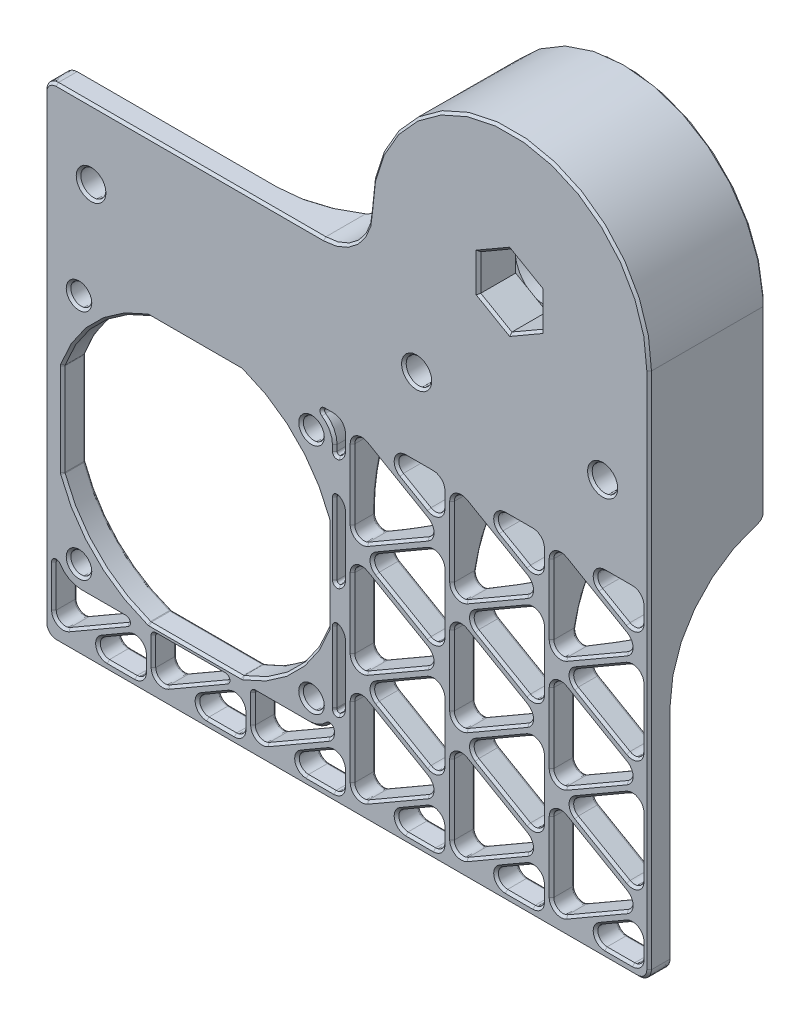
SolidWorks part; units mm, degrees
other "<Mocowanie szpulki baza z wiatrakiem>-<Sfazowanie5>"
ref_plane "Płaszczyzna przednia" through (0, 0, 0) normal (0, 0, 1) x (1, 0, 0)
ref_plane "Płaszczyzna górna" through (0, 0, 0) normal (0, 1, 0) x (1, 0, 0)
ref_plane "Płaszczyzna prawa" through (0, 0, 0) normal (1, 0, 0) x (0, 0, -1)
sketch "Szkic1-Mocowanie szpulki baza z wiatrakiem_Odbicie lustrzane" plane through (0, 0, 0) normal (0, 0, 1) x (1, 0, 0)
  line L0 (0, 0) -> (0, 40)
  line L1 (0, 0) -> (60, 0)
  line L2 (60, 0) -> (60, 40)
  arc A0 (0, 40) -> (60, 40) centre (30, 40) cw
  dimension "D1" = 60
  dimension "D2" = 40
sketch "Szkic7-Mocowanie szpulki baza z wiatrakiem_Odbicie lustrzane" plane through (0, 0, 0) normal (0, 1, 0) x (1, 0, 0)
  line L1 (0, 0) -> (60, 0)
  line L2 (0, 0) -> (0, 5)
  line L3 (0, 5) -> (60, 5)
  line L4 (60, 0) -> (60, 5)
  dimension "D1" = 5
sketch "Szkic9-Mocowanie szpulki baza z wiatrakiem_Odbicie lustrzane" plane through (0, 0, 0) normal (1, 0, 0) x (0, 0, -1)
  line L1 (5, -74) -> (0, -74)
  line L2 (5, -74) -> (5, 30)
  line L3 (5, 30) -> (0, 30)
  line L4 (0, -74) -> (0, 30)
sketch "Szkic10-Mocowanie szpulki baza z wiatrakiem_Odbicie lustrzane" plane through (0, 0, -5) normal (0, 0, 1) x (1, 0, 0)
  line L0 (10, 15) -> (-60, 15) construction
  circle A0 centre (-60, 15) radius 2.7
  dimension "D1" = 5.4
sketch "Szkic12-Mocowanie szpulki baza z wiatrakiem_Odbicie lustrzane" plane through (0, 0, 0) normal (0, 0, -1) x (-1, 0, 0)
  line L1 (-30, 47.7365) -> (-36.7, 43.8682)
  line L2 (-36.7, 43.8682) -> (-36.7, 36.1318)
  line L3 (-36.7, 36.1318) -> (-30, 32.2635)
  line L4 (-30, 32.2635) -> (-23.3, 36.1318)
  line L5 (-23.3, 36.1318) -> (-23.3, 43.8682)
  line L6 (-23.3, 43.8682) -> (-30, 47.7365)
  circle A0 centre (-30, 40) radius 6.7 construction
  dimension "D1" = 13.4
sketch "Szkic13-Mocowanie szpulki baza z wiatrakiem_Odbicie lustrzane" plane through (0, 0, -25) normal (0, 0, 1) x (1, 0, 0)
  circle A0 centre (30, 40) radius 6.2
  circle A2 centre (30, 40) radius 4.2
  dimension "D1" = 12.4
sketch "Szkic14-Mocowanie szpulki baza z wiatrakiem_Odbicie lustrzane" plane through (0, 0, -5) normal (0, 0, 1) x (1, 0, 0)
  line L0 (-70, 0) -> (60, 0) construction
  line L4 (-68, -2) -> (-68, -24)
  line L5 (-68, -24) -> (-48.9474, -13)
  line L6 (-48.9474, -13) -> (-68, -2)
  line L7 (-70, -25) -> (-36.4444, -25) construction
  line L8 (-48.9474, -37) -> (-68, -48)
  line L9 (-68, -26) -> (-48.9474, -37)
  line L10 (-68, -48) -> (-68, -26)
  line L11 (-70, -49) -> (-35.1964, -49) construction
  line L12 (-68, -50) -> (-68, -72)
  line L13 (-68, -72) -> (-48.9474, -61)
  line L14 (-48.9474, -61) -> (-68, -50)
  line L16 (-46.6, -2) -> (-46.6, -24)
  line L17 (-46.6, -24) -> (-27.5474, -13)
  line L18 (-27.5474, -13) -> (-46.6, -2)
  line L19 (-27.5474, -37) -> (-46.6, -48)
  line L20 (-46.6, -26) -> (-27.5474, -37)
  line L21 (-46.6, -48) -> (-46.6, -26)
  line L22 (-46.6, -50) -> (-46.6, -72)
  line L23 (-46.6, -72) -> (-27.5474, -61)
  line L24 (-27.5474, -61) -> (-46.6, -50)
  line L25 (-25.2, -2) -> (-25.2, -24)
  line L26 (-25.2, -24) -> (-6.1474, -13)
  line L27 (-6.1474, -13) -> (-25.2, -2)
  line L28 (-6.1474, -37) -> (-25.2, -48)
  line L29 (-25.2, -26) -> (-6.1474, -37)
  line L30 (-25.2, -48) -> (-25.2, -26)
  line L31 (-25.2, -50) -> (-25.2, -72)
  line L32 (-25.2, -72) -> (-6.1474, -61)
  line L33 (-6.1474, -61) -> (-25.2, -50)
  line L34 (-3.8, -2) -> (-3.8, -24)
  line L35 (-3.8, -24) -> (15.2526, -13)
  line L36 (15.2526, -13) -> (-3.8, -2)
  line L37 (15.2526, -37) -> (-3.8, -48)
  line L38 (-3.8, -26) -> (15.2526, -37)
  line L39 (-3.8, -48) -> (-3.8, -26)
  line L40 (-3.8, -50) -> (-3.8, -72)
  line L41 (-3.8, -72) -> (15.2526, -61)
  line L42 (15.2526, -61) -> (-3.8, -50)
  line L43 (17.6, -2) -> (17.6, -24)
  line L44 (17.6, -24) -> (36.6526, -13)
  line L45 (36.6526, -13) -> (17.6, -2)
  line L46 (36.6526, -37) -> (17.6, -48)
  line L47 (17.6, -26) -> (36.6526, -37)
  line L48 (17.6, -48) -> (17.6, -26)
  line L49 (17.6, -50) -> (17.6, -72)
  line L50 (17.6, -72) -> (36.6526, -61)
  line L51 (36.6526, -61) -> (17.6, -50)
  line L52 (39, -2) -> (39, -24)
  line L53 (39, -24) -> (58.0526, -13)
  line L54 (58.0526, -13) -> (39, -2)
  line L55 (58.0526, -37) -> (39, -48)
  line L56 (39, -26) -> (58.0526, -37)
  line L57 (39, -48) -> (39, -26)
  line L58 (39, -50) -> (39, -72)
  line L59 (39, -72) -> (58.0526, -61)
  line L60 (58.0526, -61) -> (39, -50)
  dimension "D3" = 2
  dimension "D4" = 22
  dimension "D5" = 2
  dimension "D6" = 2
  dimension "D8" = 6
sketch "Szkic15-Mocowanie szpulki baza z wiatrakiem_Odbicie lustrzane" plane through (0, 0, -5) normal (0, 0, 1) x (1, 0, 0)
  line L0 (-70, 0) -> (60, 0) construction
  line L4 (-64, -2) -> (-48.6, -10.8912)
  line L5 (-48.6, -10.8912) -> (-48.6, -2)
  line L6 (-48.6, -2) -> (-64, -2)
  line L12 (-48.6, -15.1088) -> (-65.7321, -25)
  line L13 (-65.7321, -25) -> (-48.6, -34.8912)
  line L14 (-48.6, -34.8912) -> (-48.6, -15.1088)
  line L18 (-68, -37) -> (60, -37) construction
  line L21 (-48.6, -39.1088) -> (-48.6, -58.8912)
  line L22 (-65.7321, -49) -> (-48.6, -39.1088)
  line L23 (-48.6, -58.8912) -> (-65.7321, -49)
  line L24 (-48.6, -72) -> (-64, -72)
  line L25 (-48.6, -63.1088) -> (-48.6, -72)
  line L26 (-64, -72) -> (-48.6, -63.1088)
  line L27 (-42.6, -2) -> (-27.2, -10.8912)
  line L28 (-27.2, -10.8912) -> (-27.2, -2)
  line L29 (-27.2, -2) -> (-42.6, -2)
  line L30 (-27.2, -15.1088) -> (-44.3321, -25)
  line L31 (-44.3321, -25) -> (-27.2, -34.8912)
  line L32 (-27.2, -34.8912) -> (-27.2, -15.1088)
  line L33 (-27.2, -39.1088) -> (-27.2, -58.8912)
  line L34 (-44.3321, -49) -> (-27.2, -39.1088)
  line L35 (-27.2, -58.8912) -> (-44.3321, -49)
  line L36 (-27.2, -72) -> (-42.6, -72)
  line L37 (-27.2, -63.1088) -> (-27.2, -72)
  line L38 (-42.6, -72) -> (-27.2, -63.1088)
  line L39 (-21.2, -2) -> (-5.8, -10.8912)
  line L40 (-5.8, -10.8912) -> (-5.8, -2)
  line L41 (-5.8, -2) -> (-21.2, -2)
  line L42 (-5.8, -15.1088) -> (-22.9321, -25)
  line L43 (-22.9321, -25) -> (-5.8, -34.8912)
  line L44 (-5.8, -34.8912) -> (-5.8, -15.1088)
  line L45 (-5.8, -39.1088) -> (-5.8, -58.8912)
  line L46 (-22.9321, -49) -> (-5.8, -39.1088)
  line L47 (-5.8, -58.8912) -> (-22.9321, -49)
  line L48 (-5.8, -72) -> (-21.2, -72)
  line L49 (-5.8, -63.1088) -> (-5.8, -72)
  line L50 (-21.2, -72) -> (-5.8, -63.1088)
  line L51 (0.2, -2) -> (15.6, -10.8912)
  line L52 (15.6, -10.8912) -> (15.6, -2)
  line L53 (15.6, -2) -> (0.2, -2)
  line L54 (15.6, -15.1088) -> (-1.5321, -25)
  line L55 (-1.5321, -25) -> (15.6, -34.8912)
  line L56 (15.6, -34.8912) -> (15.6, -15.1088)
  line L57 (15.6, -39.1088) -> (15.6, -58.8912)
  line L58 (-1.5321, -49) -> (15.6, -39.1088)
  line L59 (15.6, -58.8912) -> (-1.5321, -49)
  line L60 (15.6, -72) -> (0.2, -72)
  line L61 (15.6, -63.1088) -> (15.6, -72)
  line L62 (0.2, -72) -> (15.6, -63.1088)
  line L63 (21.6, -2) -> (37, -10.8912)
  line L64 (37, -10.8912) -> (37, -2)
  line L65 (37, -2) -> (21.6, -2)
  line L66 (37, -15.1088) -> (19.8679, -25)
  line L67 (19.8679, -25) -> (37, -34.8912)
  line L68 (37, -34.8912) -> (37, -15.1088)
  line L69 (37, -39.1088) -> (37, -58.8912)
  line L70 (19.8679, -49) -> (37, -39.1088)
  line L71 (37, -58.8912) -> (19.8679, -49)
  line L72 (37, -72) -> (21.6, -72)
  line L73 (37, -63.1088) -> (37, -72)
  line L74 (21.6, -72) -> (37, -63.1088)
  line L75 (43, -2) -> (58.4, -10.8912)
  line L76 (58.4, -10.8912) -> (58.4, -2)
  line L77 (58.4, -2) -> (43, -2)
  line L78 (58.4, -15.1088) -> (41.2679, -25)
  line L79 (41.2679, -25) -> (58.4, -34.8912)
  line L80 (58.4, -34.8912) -> (58.4, -15.1088)
  line L81 (58.4, -39.1088) -> (58.4, -58.8912)
  line L82 (41.2679, -49) -> (58.4, -39.1088)
  line L83 (58.4, -58.8912) -> (41.2679, -49)
  line L84 (58.4, -72) -> (43, -72)
  line L85 (58.4, -63.1088) -> (58.4, -72)
  line L86 (43, -72) -> (58.4, -63.1088)
  dimension "D4" = 2
  dimension "D8" = 6
mirrored part "Mocowanie szpulki baza z wiatrakiem_Odbicie lustrzane"
sketch "Szkic9" plane through (0, 0, -5) normal (0, 0, -1) x (-1, 0, 0)
  line L8 (67.6018, -56.5) -> (67.6018, -7.5)
  line L9 (62.1018, -2) -> (13.1018, -2)
  line L10 (7.6018, -7.5) -> (7.6018, -56.5)
  line L11 (13.1018, -62) -> (62.1018, -62)
  line L12 (27.6018, -60.5) -> (47.6018, -60.5)
  line L13 (9.1018, -22) -> (9.1018, -42)
  line L14 (27.6018, -3.5) -> (47.6018, -3.5)
  line L15 (66.1018, -22) -> (66.1018, -42)
  arc A8 (62.1018, -62) -> (67.6018, -56.5) centre (62.1018, -56.5) ccw
  arc A9 (67.6018, -7.5) -> (62.1018, -2) centre (62.1018, -7.5) ccw
  arc A10 (13.1018, -2) -> (7.6018, -7.5) centre (13.1018, -7.5) ccw
  arc A11 (7.6018, -56.5) -> (13.1018, -62) centre (13.1018, -56.5) ccw
  arc A12 (9.1018, -42) -> (27.6018, -60.5) centre (37.6018, -32) ccw
  arc A13 (27.6018, -3.5) -> (9.1018, -22) centre (37.6018, -32) ccw
  arc A14 (47.6018, -60.5) -> (66.1018, -42) centre (37.6018, -32) ccw
  arc A15 (66.1018, -22) -> (47.6018, -3.5) centre (37.6018, -32) ccw
  circle A20 centre (12.6018, -7) radius 2.25
  circle A21 centre (62.6018, -7) radius 2.25
  circle A22 centre (62.6018, -57) radius 2.25
  circle A23 centre (12.6018, -57) radius 2.25
sketch "Szkic10" plane through (0, 0, 0) normal (0, 0, 1) x (1, 0, 0)
  line L0 (-7.6018, -7.5) -> (-7.6018, -56.5) construction
  line L1 (-13.1018, -62) -> (-62.1018, -62) construction
  line L2 (-67.6018, -56.5) -> (-67.6018, -7.5) construction
  line L3 (-62.1018, -2) -> (-13.1018, -2) construction
  line L4 (-7.6018, -7.5) -> (-7.6018, -56.5)
  line L5 (-13.1018, -62) -> (-62.1018, -62)
  line L6 (-67.6018, -56.5) -> (-67.6018, -7.5)
  line L7 (-62.1018, -2) -> (-13.1018, -2)
  arc A0 (-13.1018, -62) -> (-7.6018, -56.5) centre (-13.1018, -56.5) ccw construction
  arc A1 (-67.6018, -56.5) -> (-62.1018, -62) centre (-62.1018, -56.5) ccw construction
  arc A2 (-62.1018, -2) -> (-67.6018, -7.5) centre (-62.1018, -7.5) ccw construction
  arc A3 (-7.6018, -7.5) -> (-13.1018, -2) centre (-13.1018, -7.5) ccw construction
  arc A4 (-13.1018, -62) -> (-7.6018, -56.5) centre (-13.1018, -56.5) ccw
  arc A5 (-67.6018, -56.5) -> (-62.1018, -62) centre (-62.1018, -56.5) ccw
  arc A6 (-62.1018, -2) -> (-67.6018, -7.5) centre (-62.1018, -7.5) ccw
  arc A7 (-7.6018, -7.5) -> (-13.1018, -2) centre (-13.1018, -7.5) ccw
extrude "Dodanie-wyciągnięcie1" add sketch "Szkic10" against normal up to surface (5 mm away)
sketch "Szkic11" plane through (0, 0, 0) normal (0, 0, 1) x (1, 0, 0)
  line L0 (-68, -53.4641) -> (-68, -68.5359) construction
  line L1 (-67.6018, -52.2665) -> (-67.6018, -56.5) construction
  line L2 (-67.6018, -28.2665) -> (-67.6018, -45.7335) construction
  line L3 (-68, -29.4641) -> (-68, -44.5359) construction
  line L4 (-67.6018, -7.5) -> (-67.6018, -21.7335) construction
  line L5 (-68, -5.4641) -> (-68, -20.5359) construction
  line L6 (-68, -53.4641) -> (-68, -56.1018)
  line L7 (-67.6018, -52.2665) -> (-67.6018, -56.5)
  line L8 (-67.6018, -28.2665) -> (-67.6018, -45.7335)
  line L9 (-68, -29.4641) -> (-68, -44.5359)
  line L10 (-67.6018, -7.5) -> (-67.6018, -21.7335)
  line L11 (-68, -5.4641) -> (-68, -20.5359)
  line L12 (-62.1018, -62) -> (-51.2154, -62) construction
  arc A0 (-67.6018, -52.2665) -> (-68, -53.4641) centre (-66, -53.4641) ccw construction
  arc A1 (-68, -44.5359) -> (-67.6018, -45.7335) centre (-66, -44.5359) ccw construction
  arc A2 (-67.6018, -28.2665) -> (-68, -29.4641) centre (-66, -29.4641) ccw construction
  arc A3 (-68, -20.5359) -> (-67.6018, -21.7335) centre (-66, -20.5359) ccw construction
  arc A4 (-65.8448, -3.4701) -> (-67.6018, -7.5) centre (-62.1018, -7.5) ccw construction
  arc A5 (-65.8448, -3.4701) -> (-68, -5.4641) centre (-66, -5.4641) ccw construction
  arc A6 (-67.6018, -52.2665) -> (-68, -53.4641) centre (-66, -53.4641) ccw
  arc A7 (-68, -44.5359) -> (-67.6018, -45.7335) centre (-66, -44.5359) ccw
  arc A8 (-67.6018, -28.2665) -> (-68, -29.4641) centre (-66, -29.4641) ccw
  arc A9 (-68, -20.5359) -> (-67.6018, -21.7335) centre (-66, -20.5359) ccw
  arc A10 (-65.8448, -3.4701) -> (-67.6018, -7.5) centre (-62.1018, -7.5) ccw
  arc A11 (-65.8448, -3.4701) -> (-68, -5.4641) centre (-66, -5.4641) ccw
  arc A12 (-62.1018, -62) -> (-68, -56.1018) centre (-62.1018, -56.1018) cw
  arc A13 (-67.6018, -56.5) -> (-62.1018, -62) centre (-62.1018, -56.5) ccw construction
  arc A14 (-67.6018, -56.5) -> (-62.1018, -62) centre (-62.1018, -56.5) ccw
extrude "Dodanie-wyciągnięcie2" add sketch "Szkic11" against normal up to surface (5 mm away)
sketch "Szkic12" plane through (0, 0, -5) normal (0, 0, -1) x (-1, 0, 0)
  line L0 (9.1474, -14.7321) -> (10.2504, -15.3688) construction
  line L1 (18.5492, -5.8399) -> (9.1474, -11.2679) construction
  line L2 (9.1474, -14.7321) -> (10.2504, -15.3688)
  line L3 (8.8, -9.1591) -> (14.7359, -5.7321)
  line L4 (13.7359, -2) -> (13.1018, -2)
  line L5 (7.6018, -7.5) -> (7.6018, -9.4173)
  line L6 (8.8, -9.1591) -> (14.7359, -5.7321)
  line L7 (13.7359, -2) -> (13.1018, -2)
  line L8 (7.6018, -7.5) -> (7.6018, -9.4173)
  line L9 (18.5492, -5.8399) -> (9.1474, -11.2679)
  arc A0 (9.1474, -11.2679) -> (9.1474, -14.7321) centre (10.1474, -13) ccw construction
  arc A1 (9.1474, -11.2679) -> (9.1474, -14.7321) centre (10.1474, -13) ccw
  arc A3 (14.7359, -5.7321) -> (13.7359, -2) centre (13.7359, -4) ccw
  arc A4 (13.1018, -2) -> (7.6018, -7.5) centre (13.1018, -7.5) ccw
  arc A5 (7.6018, -9.4173) -> (8.8, -9.1591) centre (7.8, -7.4271) ccw
  arc A6 (14.7359, -5.7321) -> (13.7359, -2) centre (13.7359, -4) ccw
  arc A7 (13.1018, -2) -> (7.6018, -7.5) centre (13.1018, -7.5) ccw
  arc A8 (7.6018, -9.4173) -> (8.8, -9.1591) centre (7.8, -7.4271) ccw
  arc A9 (18.5492, -5.8399) -> (10.2504, -15.3688) centre (-15, 15) cw
  arc A10 (18.5492, -5.8399) -> (24.4949, 15) centre (-15, 15) ccw construction
  dimension "D1" = 0
extrude "Dodanie-wyciągnięcie3" add sketch "Szkic12" along normal up to surface (1.1842 mm away)
sketch "Szkic13" plane through (0, 0, 0) normal (0, 0, 1) x (1, 0, 0)
  line L0 (-66.1018, -22) -> (-66.1018, -42) construction
  line L1 (-27.6018, -60.5) -> (-47.6018, -60.5) construction
  line L2 (-9.1018, -22) -> (-9.1018, -42) construction
  line L3 (-27.6018, -3.5) -> (-47.6018, -3.5) construction
  line L4 (-66.1018, -22) -> (-66.1018, -42)
  line L5 (-27.6018, -60.5) -> (-47.6018, -60.5)
  line L6 (-9.1018, -22) -> (-9.1018, -42)
  line L7 (-27.6018, -3.5) -> (-47.6018, -3.5)
  arc A0 (-66.1018, -42) -> (-47.6018, -60.5) centre (-37.6018, -32) ccw construction
  arc A1 (-27.6018, -60.5) -> (-9.1018, -42) centre (-37.6018, -32) ccw construction
  arc A2 (-9.1018, -22) -> (-27.6018, -3.5) centre (-37.6018, -32) ccw construction
  arc A3 (-47.6018, -3.5) -> (-66.1018, -22) centre (-37.6018, -32) ccw construction
  arc A4 (-66.1018, -42) -> (-47.6018, -60.5) centre (-37.6018, -32) ccw
  arc A5 (-27.6018, -60.5) -> (-9.1018, -42) centre (-37.6018, -32) ccw
  arc A6 (-9.1018, -22) -> (-27.6018, -3.5) centre (-37.6018, -32) ccw
  arc A7 (-47.6018, -3.5) -> (-66.1018, -22) centre (-37.6018, -32) ccw
  circle A8 centre (-12.6018, -57) radius 2.25 construction
  circle A9 centre (-62.6018, -57) radius 2.25 construction
  circle A10 centre (-12.6018, -7) radius 2.25 construction
  circle A11 centre (-62.6018, -7) radius 2.25 construction
  circle A12 centre (-12.6018, -57) radius 2.25
  circle A13 centre (-62.6018, -57) radius 2.25
  circle A14 centre (-12.6018, -7) radius 2.25
  circle A15 centre (-62.6018, -7) radius 2.25
extrude "Wytnij-wyciągnięcie2" cut sketch "Szkic13" against normal through all and the other way through all
fillet "Zaokrąglenie1" radius 0.5 2 edges at (-7.6018, -9.4173, -2.8934) (-13.1018, -2, -2.9505)
fillet "Zaokrąglenie2" radius 0.5 10 edges at (-68, -56.1018, -2.5) (-51.2154, -62, -2.5) (-29.8154, -62, -2.5) (-46.6, -62, -2.5) (-8.6281, -59.6994, -2.5) (-25.2, -62, -2.5) (-7.6018, -40.5827, -2.5) (-7.6799, -57.4235, -2.5) (-7.6018, -33.4173, -2.5) (-7.6018, -16.5827, -2.5)
fillet "Zaokrąglenie3" radius 0.5 8 edges at (-27.6018, -60.5, -2.5) (-9.1018, -42, -2.5) (-47.6018, -60.5, -2.5) (-66.1018, -42, -2.5) (-66.1018, -22, -2.5) (-9.1018, -22, -2.5) (-47.6018, -3.5, -2.5) (-27.6018, -3.5, -2.5)
sketch "Szkic14" plane through (0, 0, -5) normal (0, 0, -1) x (-1, 0, 0)
  circle A0 centre (12.6018, -7) radius 4
  dimension "D1" = 8
extrude "Wytnij-wyciągnięcie3" cut sketch "Szkic14" along normal blind 10
fillet "Zaokrąglenie4" radius 0.5 212 edges at (48.5263, -66.5, -5) (48.5263, -42.5, -5) (48.6539, -18.4263, -5.7477) (27.2539, -18.4263, -5.7477) (27.1263, -42.5, -5) (27.1263, -66.5, -5) (5.7263, -66.5, -5) (5.7263, -42.5, -5) (-15.6737, -66.5, -5) (56.0526, -61, -5) (56.0526, -37, -5) (56.0525, -12.9927, -7.8032) (34.6525, -12.9927, -7.8032) (34.6526, -37, -5) (34.6526, -61, -5) (13.2526, -61, -5) (13.2526, -37, -5) (13.2509, -12.9195, -7.8127) (-57.3, 15, -5) (48.5263, -55.5, -5) (27.1263, -55.5, -5) (5.7263, -55.5, -5) (48.5263, -31.5, -5) (27.1263, -31.5, -5) (5.7263, -31.5, -5) (47.857, -7.1136, -12.0309) (26.457, -7.1136, -12.0309) (7.5009, -8.5246, -9.8545) (40, -51.7321, -5) (18.6, -51.7321, -5) (-2.8, -51.7321, -5) (40, -27.7321, -5) (18.6, -27.7321, -5) (-2.8, -27.7321, -5) (40.5916, -3.5063, -16.4178) (19.1916, -3.5063, -16.4178) (-2.7605, -3.7098, -9.0866) (39, -12.2442, -8.2073) (17.6, -12.2442, -8.2073) (-3.8, -20.1346, -5) (-3.8, -37, -5) (17.6, -37, -5) (39, -37, -5) (39, -61, -5) (17.6, -61, -5) (-3.8, -61, -5) (-25.2, -65.5179, -5) (-46.6, -65.5179, -5) (-68, -64.0362, -5) (40.0673, -22.3051, -5.0961) (18.6673, -22.3051, -5.0961) (-2.8, -22.2679, -5) (-2.8, -46.2679, -5) (18.6, -46.2679, -5) (40, -46.2679, -5) (40, -70.2679, -5) (18.6, -70.2679, -5) (-2.8, -70.2679, -5) (-24.2, -70.2679, -5) (-45.6, -70.2679, -5) (-67, -70.2679, -5) (30.9005, -7.3696, -11.7867) (7.034, -29.9456, -5) (28.434, -29.9456, -5) (28.434, -53.9456, -5) (7.034, -53.9456, -5) (-53.5679, -72, -5) (-32.1679, -72, -5) (-10.7679, -72, -5) (10.6321, -72, -5) (32.0321, -72, -5) (53.4321, -72, -5) (49.834, -53.9456, -5) (49.834, -29.9456, -5) (52.3005, -7.3696, -11.7867) (-5.9226, -8.1166, -6.4236) (15.4563, -8.1714, -11.0647) (13.8811, -9.4072, -10.0467) (35.9951, -9.162, -10.2541) (14.6, -33.1591, -5) (36, -33.1591, -5) (36, -57.1591, -5) (14.6, -57.1591, -5) (-6.0902, -56.4646, -5) (-49.1858, -71.4142, -5) (-27.7858, -71.4142, -5) (-6.3858, -71.4142, -5) (15.0142, -71.4142, -5) (36.4142, -71.4142, -5) (57.8142, -71.4142, -5) (57.4, -57.1591, -5) (57.4, -33.1591, -5) (57.3951, -9.162, -10.2541) (-48.6, -68.2865, -5) (-27.2, -68.2865, -5) (15.6, -68.2865, -5) (-5.8, -68.2865, -5) (-5.8, -49, -5) (15.6, -49, -5) (37, -49, -5) (37, -68.2865, -5) (58.4, -68.2865, -5) (58.4, -49, -5) (37, -21.5126, -5.1785) (15.6, -21.5126, -5.1785) (15.6, -5.6099, -13.6183) (37, -5.6099, -13.6183) (58.4, -21.5126, -5.1785) (58.4, -5.6099, -13.6183) (-49.6, -64.8409, -5) (-28.2, -64.8409, -5) (14.6, -64.8409, -5) (-6.8, -64.8409, -5) (14.6, -40.8409, -5) (36, -40.8409, -5) (36, -64.8409, -5) (57.4, -64.8409, -5) (57.4, -40.8409, -5) (35.8599, -16.7672, -6.2243) (13.8507, -16.5887, -6.2761) (15.4016, -17.7044, -5.9399) (-6.5547, -2.435, -7.9448) (14.1375, -2.0736, -18.8978) (15.5267, -3.4634, -16.4842) (35.6696, -2.1154, -18.8574) (57.2599, -16.7672, -6.2243) (57.0696, -2.1154, -18.8574) (-18.9009, -62, -5) (-7.6031, -56.6181, -5) (-64.9403, -61.2721, -5) (-7.8913, -5.7392, -6.5279) (-60.3518, -7, -5) (-60.3518, -57, -5) (-10.3518, -57, -5) (-7.6018, 37.0703, -53.7174) (-7.3739, -9.1742, -5.8749) (-10.2811, -2.4363, -6.594) (-58.6478, -66.6005, -5) (-57.3237, -62, -5) (-37.2478, -66.6005, -5) (-38.6228, -62, -5) (-8.2924, -61.7476, -5) (-10.9041, -61.5418, -5) (-6.088, -41.5389, -5) (-7.6018, -48.8726, -5) (-67.6398, -59.0563, -5) (-52.0626, -62.3706, -5) (-30.6626, -62.3706, -5) (-46.4536, -62.1464, -5) (-8.5904, -60.0976, -5) (-25.0536, -62.1464, -5) (-7.3603, -40.8173, -5) (-7.3759, -57.1794, -5) (-16.2447, -53.3571, -5) (-37.6018, -60.5, -5) (-9.1018, -32, -5) (-58.9589, -53.3571, -5) (-66.1018, -32, -5) (-58.9589, -10.6429, -5) (-16.2447, -10.6429, -5) (-37.6018, -3.5, -5) (-27.6027, -60.4928, -5) (-9.1091, -41.9991, -5) (-47.601, -60.4928, -5) (-66.0946, -41.9991, -5) (-66.0946, -22.0009, -5) (-9.1091, -22.0009, -5) (-47.601, -3.5072, -5) (-27.6027, -3.5072, -5) (-9.2054, -4.8871, -6.3718) (-0.2625, -21.9576, -5) (15.6, -27.961, -5) (58.4, -27.961, -5) (37, -27.961, -5) (52.4321, -66.5544, -5) (31.0321, -66.5544, -5) (9.6321, -66.5544, -5) (-11.7679, -66.5544, -5) (-33.1679, -66.5544, -5) (-54.5679, -66.5544, -5) (49.834, -44.0544, -5) (49.9005, -20.016, -5.4045) (28.434, -44.0544, -5) (28.5005, -20.016, -5.4045) (7.034, -44.0544, -5) (2.0983, -22.904, -5) (53.4321, -2, -19.0922) (32.0321, -2, -19.0922) (11.3031, -2, -18.3082) (48.5322, -70.5176, -5) (27.1322, -70.5176, -5) (5.7322, -70.5176, -5) (-15.6678, -70.5176, -5) (-37.0678, -70.5176, -5) (-58.4678, -70.5176, -5) (43.2679, -49, -5) (43.4227, -25.7714, -5) (43.6087, -23.8834, -5.0075) (21.8679, -49, -5) (22.0227, -25.7714, -5) (22.2087, -23.8834, -5.0075) (0.4679, -49, -5) (0.4679, -25, -5) (49.0321, -2.6038, -17.9261) (27.6321, -2.6038, -17.9261) (5.6866, -4.2988, -12.7197)
chamfer "Sfazowanie1" distance 0.5 angle 45 224 edges at (59.2678, -73.2678, 0) (-5, -74, 0) (-69.2678, -73.2678, 0) (-70, -22, 0) (-69.2678, 29.2678, 0) (-38.75, 30, 0) (-2.9289, 32.9289, 0) (30, 70, 0) (60, -15.75, 0) (52.75, 15, 0) (12.75, 15, 0) (-57.3, 15, 0) (23.3, 40, 0) (26.65, 34.1976, 0) (33.35, 34.1976, 0) (36.7, 40, 0) (33.35, 45.8024, 0) (26.65, 45.8024, 0) (40, -70.2679, 0) (48.5263, -66.5, 0) (56.0526, -61, 0) (48.5263, -55.5, 0) (40, -51.7321, 0) (39, -61, 0) (18.6, -22.2679, 0) (27.1263, -18.5, 0) (34.6526, -13, 0) (27.1263, -7.5, 0) (18.6, -3.7321, 0) (17.6, -13, 0) (-2.8, -70.2679, 0) (5.7263, -66.5, 0) (13.2526, -61, 0) (5.7263, -55.5, 0) (-2.8, -51.7321, 0) (-3.8, -61, 0) (-2.8, -46.2679, 0) (5.7263, -42.5, 0) (13.2526, -37, 0) (5.7263, -31.5, 0) (-2.8, -27.7321, 0) (-3.8, -37, 0) (-2.8, -22.2679, 0) (5.7263, -18.5, 0) (13.2526, -13, 0) (5.7263, -7.5, 0) (-2.8, -3.7321, 0) (-3.8, -13, 0) (18.6, -46.2679, 0) (27.1263, -42.5, 0) (34.6526, -37, 0) (27.1263, -31.5, 0) (18.6, -27.7321, 0) (17.6, -37, 0) (18.6, -70.2679, 0) (27.1263, -66.5, 0) (34.6526, -61, 0) (27.1263, -55.5, 0) (18.6, -51.7321, 0) (17.6, -61, 0) (40, -22.2679, 0) (48.5263, -18.5, 0) (56.0526, -13, 0) (48.5263, -7.5, 0) (40, -3.7321, 0) (39, -13, 0) (40, -46.2679, 0) (48.5263, -42.5, 0) (56.0526, -37, 0) (48.5263, -31.5, 0) (40, -27.7321, 0) (39, -37, 0) (57.8142, -2.5858, 0) (53.4321, -2, 0) (48.5322, -3.4824, 0) (52.4321, -7.4456, 0) (57.4, -9.1591, 0) (58.4, -5.7135, 0) (36.4142, -71.4142, 0) (37, -68.2865, 0) (36, -64.8409, 0) (31.0321, -66.5544, 0) (27.1322, -70.5176, 0) (32.0321, -72, 0) (36, -40.8409, 0) (28.434, -44.0544, 0) (21.8679, -49, 0) (28.434, -53.9456, 0) (36, -57.1591, 0) (37, -49, 0) (36, -33.1591, 0) (37, -25, 0) (36, -16.8409, 0) (28.434, -20.0544, 0) (21.8679, -25, 0) (28.434, -29.9456, 0) (57.4, -33.1591, 0) (58.4, -25, 0) (57.4, -16.8409, 0) (49.834, -20.0544, 0) (43.2679, -25, 0) (49.834, -29.9456, 0) (57.4, -40.8409, 0) (49.834, -44.0544, 0) (43.2679, -49, 0) (49.834, -53.9456, 0) (57.4, -57.1591, 0) (58.4, -49, 0) (57.8142, -71.4142, 0) (58.4, -68.2865, 0) (57.4, -64.8409, 0) (52.4321, -66.5544, 0) (48.5322, -70.5176, 0) (53.4321, -72, 0) (-27.7858, -71.4142, 0) (-27.2, -68.2865, 0) (-28.2, -64.8409, 0) (-33.1679, -66.5544, 0) (-37.0678, -70.5176, 0) (-32.1679, -72, 0) (-49.1858, -71.4142, 0) (-48.6, -68.2865, 0) (-49.6, -64.8409, 0) (-54.5679, -66.5544, 0) (-58.4678, -70.5176, 0) (-53.5679, -72, 0) (14.6, -33.1591, 0) (15.6, -25, 0) (14.6, -16.8409, 0) (7.034, -20.0544, 0) (0.4679, -25, 0) (7.034, -29.9456, 0) (14.6, -40.8409, 0) (7.034, -44.0544, 0) (0.4679, -49, 0) (7.034, -53.9456, 0) (14.6, -57.1591, 0) (15.6, -49, 0) (15.0142, -71.4142, 0) (15.6, -68.2865, 0) (14.6, -64.8409, 0) (9.6321, -66.5544, 0) (5.7322, -70.5176, 0) (10.6321, -72, 0) (36.4142, -2.5858, 0) (32.0321, -2, 0) (27.1322, -3.4824, 0) (31.0321, -7.4456, 0) (36, -9.1591, 0) (37, -5.7135, 0) (-6.3858, -71.4142, 0) (-5.8, -68.2865, 0) (-6.8, -64.8409, 0) (-11.7679, -66.5544, 0) (-15.6678, -70.5176, 0) (-10.7679, -72, 0) (15.0142, -2.5858, 0) (10.6321, -2, 0) (5.7322, -3.4824, 0) (9.6321, -7.4456, 0) (14.6, -9.1591, 0) (15.6, -5.7135, 0) (-5.8, -5.7135, 0) (-6.3858, -2.5858, 0) (-8.7926, -2, 0) (-10.2639, -2.3557, 0) (-8.2556, -4.8992, 0) (-7.6018, -8.1274, 0) (-7.3603, -9.1827, 0) (-6.088, -8.4611, 0) (-5.8, -25, 0) (-6.088, -17.5389, 0) (-7.3603, -16.8173, 0) (-7.6018, -25, 0) (-7.3603, -33.1827, 0) (-6.088, -32.4611, 0) (-24.2, -70.2679, 0) (-15.6737, -66.5, 0) (-8.2924, -61.7476, 0) (-8.5904, -60.0976, 0) (-10.9041, -61.5418, 0) (-18.9009, -62, 0) (-25.0536, -62.1464, 0) (-25.2, -65.5179, 0) (-45.6, -70.2679, 0) (-37.2478, -66.6005, 0) (-30.6626, -62.3706, 0) (-38.6228, -62, 0) (-46.4536, -62.1464, 0) (-46.6, -65.5179, 0) (-5.8, -49, 0) (-6.088, -41.5389, 0) (-7.3603, -40.8173, 0) (-7.6018, -48.8726, 0) (-7.6031, -56.6181, 0) (-7.3759, -57.1794, 0) (-6.0902, -56.4646, 0) (-67, -70.2679, 0) (-58.6478, -66.6005, 0) (-52.0626, -62.3706, 0) (-57.3237, -62, 0) (-64.9403, -61.2721, 0) (-67.6398, -59.0563, 0) (-68, -64.0362, 0) (-66.0946, -22.0009, 0) (-66.1018, -32, 0) (-66.0946, -41.9991, 0) (-58.9589, -53.3571, 0) (-47.601, -60.4928, 0) (-37.6018, -60.5, 0) (-27.6027, -60.4928, 0) (-16.2447, -53.3571, 0) (-9.1091, -41.9991, 0) (-9.1018, -32, 0) (-9.1091, -22.0009, 0) (-16.2447, -10.6429, 0) (-27.6027, -3.5072, 0) (-37.6018, -3.5, 0) (-47.601, -3.5072, 0) (-58.9589, -10.6429, 0) (-10.3518, -57, 0) (-60.3518, -57, 0) (-10.3518, -7, 0) (-60.3518, -7, 0)
